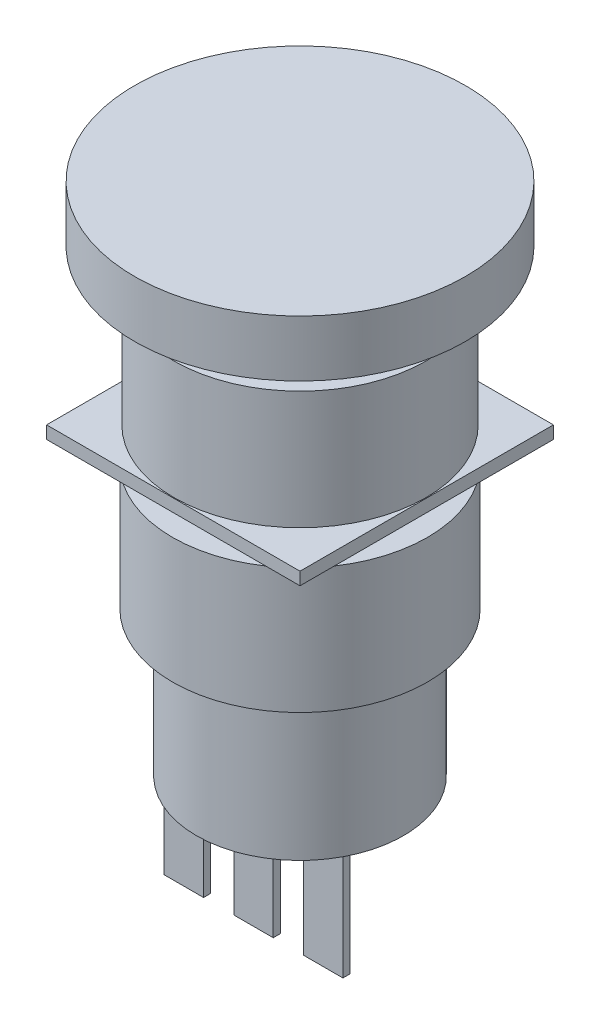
SolidWorks part; units mm, degrees
ref_plane "Plano frontal" through (0, 0, 0) normal (0, 0, 1) x (1, 0, 0)
ref_plane "Plano superior" through (0, 0, 0) normal (0, 1, 0) x (1, 0, 0)
ref_plane "Plano direito" through (0, 0, 0) normal (1, 0, 0) x (0, 0, -1)
sketch "Esboço1" plane through (0, 0, 0) normal (0, 0, 1) x (1, 0, 0)
  line L0 (0, 0) -> (0, -30) construction
  line L1 (0, 0) -> (-8.95, 0)
  line L2 (-8.95, 0) -> (-8.95, -8.4)
  line L3 (-8.95, -8.4) -> (-7.35, -8.4)
  line L4 (-7.35, -8.4) -> (-7.35, -30)
  line L5 (-7.35, -30) -> (0, -30)
  line L6 (0, 0) -> (0, -30)
  dimension "D1" = 30
  dimension "D2" = 8.4
  dimension "D3" = 17.9
  dimension "D4" = 14.7
revolve "Revolução1" add sketch "Esboço1" angle 360 about L0
sketch "Esboço2" plane through (0, -8.4, 0) normal (0, -1, 0) x (1, 0, 0)
  line L1 (9, -9) -> (-9, -9)
  line L2 (9, -9) -> (9, 9)
  line L3 (9, 9) -> (-9, 9)
  line L4 (-9, -9) -> (-9, 9)
  line L5 (9, -9) -> (-9, 9) construction
  line L6 (9, 9) -> (-9, -9) construction
  point P0 (0, 0)
  dimension "D1" = 18
extrude "Ressalto-extrusão1" add sketch "Esboço2" along normal blind 0.9
sketch "Esboço3" plane through (0, 0, 0) normal (0, 0, 1) x (1, 0, 0)
  line L0 (0, 0) -> (0, -3.8) construction
  line L1 (-11.75, 6.6) -> (-11.75, 2.6)
  line L2 (-11.75, 2.6) -> (-7.8, 2.6)
  line L3 (-7.8, 2.6) -> (-7.8, -3.8)
  line L4 (-7.8, -3.8) -> (0, -3.8)
  line L5 (-11.75, 6.6) -> (0, 6.6)
  line L6 (0, 6.6) -> (0, 0) construction
  line L7 (-7.35, -30) -> (7.35, -30) construction
  line L8 (0, -3.8) -> (0, 6.6)
  dimension "D1" = 23.5
  dimension "D2" = 4
  dimension "D3" = 10.4
  dimension "D4" = 15.6
  dimension "D5" = 36.6
revolve "Revolução2" add sketch "Esboço3" angle 360 about L8
sketch "Esboço4" plane through (0, 0, 0) normal (0, 0, 1) x (1, 0, 0)
  line L0 (-7.35, -30) -> (7.35, -30) construction
  line L1 (-6.35, -30) -> (-3.55, -30)
  line L2 (-6.35, -30) -> (-6.35, -37.6)
  line L3 (-6.35, -37.6) -> (-3.55, -37.6)
  line L4 (-3.55, -30) -> (-3.55, -37.6)
  line L5 (0, -30) -> (0, 0) construction
  line L6 (-1.4, -30) -> (1.4, -30)
  line L7 (-1.4, -30) -> (-1.4, -37.6)
  line L8 (-1.4, -37.6) -> (1.4, -37.6)
  line L9 (1.4, -30) -> (1.4, -37.6)
  line L10 (3.55, -30) -> (6.35, -30)
  line L11 (3.55, -30) -> (3.55, -37.6)
  line L12 (3.55, -37.6) -> (6.35, -37.6)
  line L13 (6.35, -30) -> (6.35, -37.6)
  line L14 (-3.55, -37.6) -> (-1.4, -37.6) construction
  line L15 (1.4, -37.6) -> (3.55, -37.6) construction
  dimension "D1" = 2.8
  dimension "D2" = 7.6
  dimension "D3" = 12.7
extrude "Ressalto-extrusão2" add sketch "Esboço4" along normal blind 0.5 from offset 2.8
sketch "Esboço5" plane through (0, 0, 0) normal (0, 0, 1) x (1, 0, 0)
  line L0 (-9.05, -10.8) -> (-9.05, -19.7)
  line L1 (-9.05, -19.7) -> (-7.45, -19.7)
  line L2 (-7.45, -19.7) -> (-7.45, -10.8)
  line L3 (-7.45, -10.8) -> (-9.05, -10.8)
  line L4 (0, 0) -> (0, -43.6299) construction
  line L5 (9, -9.3) -> (-9, -9.3) construction
  dimension "D1" = 18.1
  dimension "D2" = 1.6
  dimension "D3" = 8.9
  dimension "D4" = 1.5
revolve "Revolução3" add sketch "Esboço5" angle 360 about L4
sketch "Esboço6" [suppressed] plane through (0, 9.4, 0) normal (0, 1, 0) x (1, 0, 0)
  circle A0 centre (0, 0) radius 7.8 construction
  circle A1 centre (0, 0) radius 7.8
  circle A2 centre (0, 0) radius 11.75 construction
  circle A3 centre (0, 0) radius 11.75
extrude "Corte-extrusão1" [suppressed] cut sketch "Esboço6" against normal up to surface (4 mm away)
